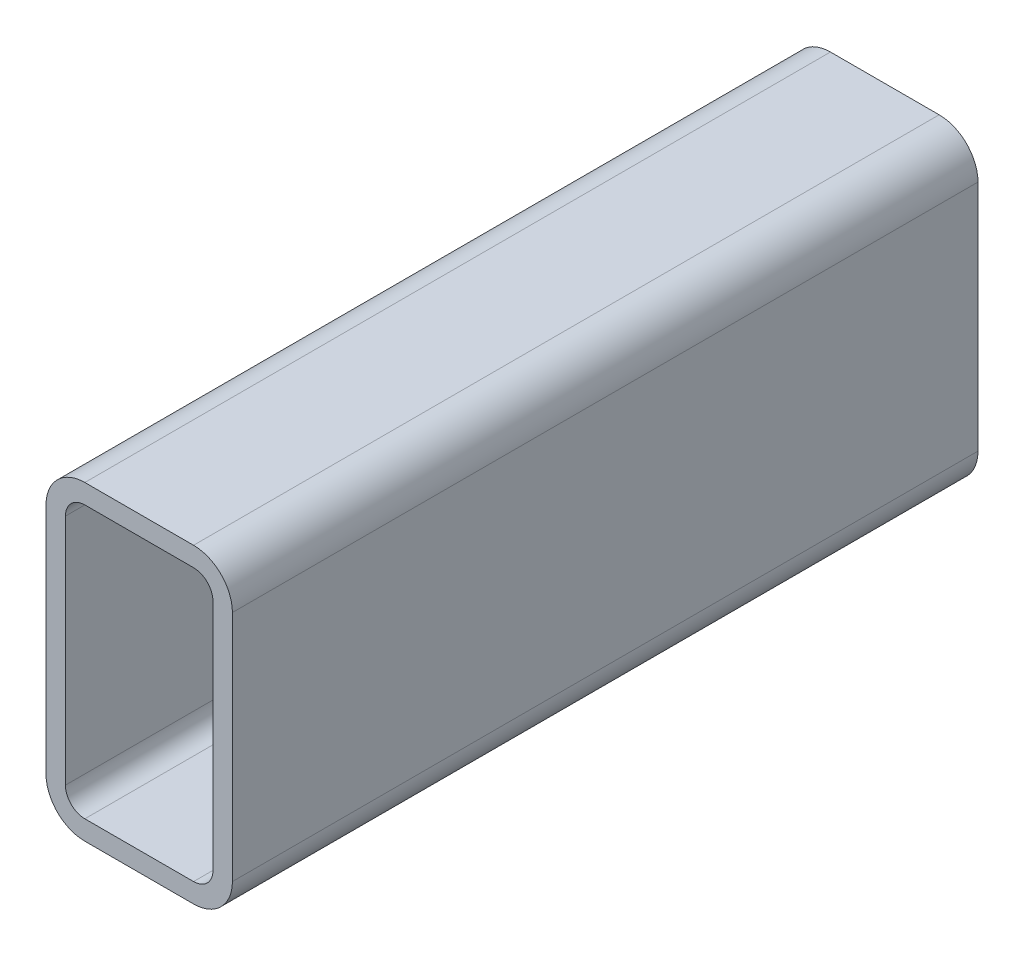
SolidWorks part; units mm, degrees
ref_plane "Front Plane" through (0, 0, 0) normal (0, 0, 1) x (1, 0, 0)
ref_plane "Top Plane" through (0, 0, 0) normal (0, 1, 0) x (1, 0, 0)
ref_plane "Right Plane" through (0, 0, 0) normal (1, 0, 0) x (0, 0, -1)
sketch "Sketch1" plane through (0, 0, 0) normal (0, 0, 1) x (1, 0, 0)
sketch_block_instance "HSS5x3x0.3125-1"
sketch_block "HSS5x3x0.3125"
extrude "Boss-Extrude1" add sketch "Sketch1" along normal blind 304.8
